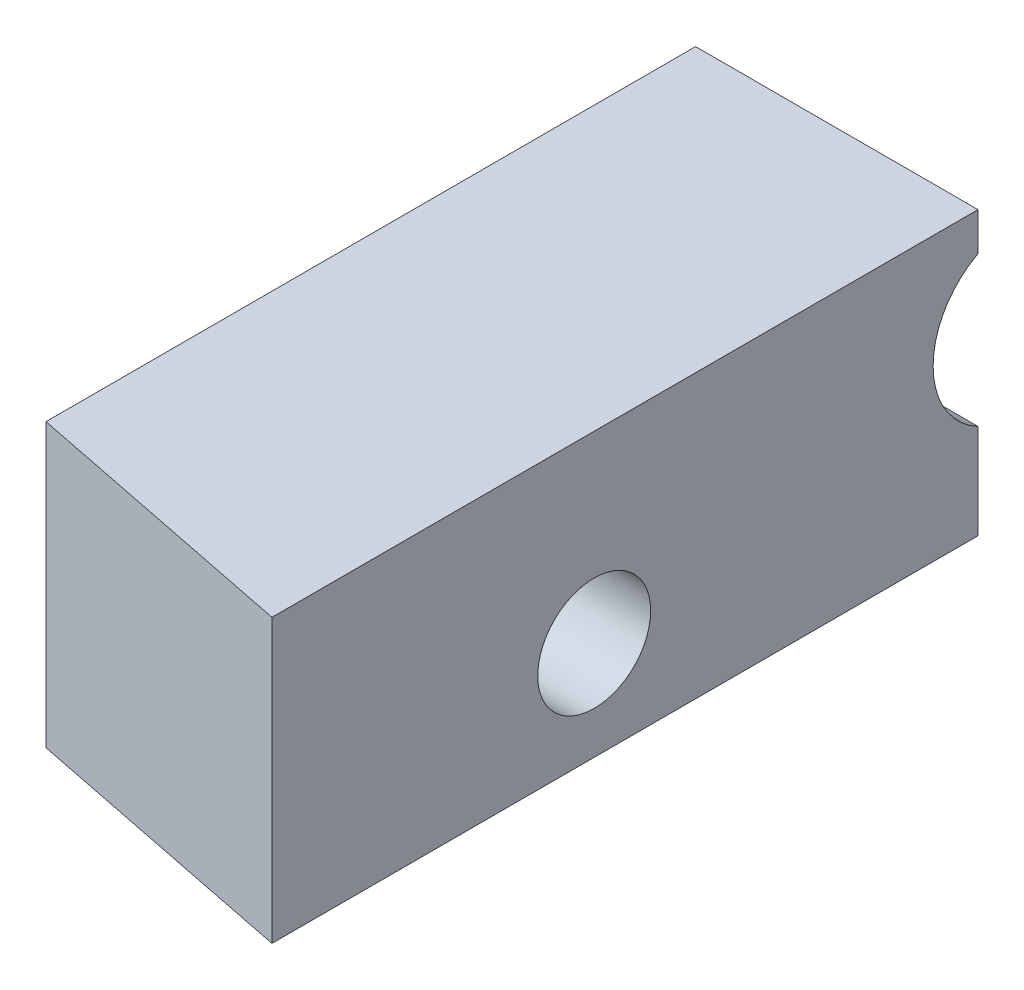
SolidWorks part; units mm, degrees
ref_plane "Plan de face" through (0, 0, 0) normal (0, 0, 1) x (1, 0, 0)
ref_plane "Plan de dessus" through (0, 0, 0) normal (0, 1, 0) x (1, 0, 0)
ref_plane "Plan de droite" through (0, 0, 0) normal (1, 0, 0) x (0, 0, -1)
sketch "Esquisse1" plane through (0, 0, 0) normal (0, 0, 1) x (1, 0, 0)
  line L1 (0, 0) -> (10, 0)
  line L2 (0, 0) -> (0, 10)
  line L3 (0, 10) -> (10, 10)
  line L4 (10, 0) -> (10, 10)
  dimension "D1" = 10
  dimension "D2" = 10
extrude "Extrusion1" add sketch "Esquisse1" along normal blind 25
sketch "Esquisse2" plane through (10, 0, 0) normal (1, 0, 0) x (0, 0, -1)
  line L0 (-25, 10) -> (0, 10) construction
  line L2 (1.4107, 3) -> (1.4107, 9)
  arc A1 (1.4107, 3) -> (1.4107, 9) centre (1.4107, 6) cw
  dimension "D1" = 3
  dimension "D2" = 4
extrude "Enlèv. mat.-Extru.1" cut sketch "Esquisse2" against normal through all
sketch "Esquisse3" plane through (10, 0, 0) normal (1, 0, 0) x (0, 0, -1)
  line L0 (1.4107, 6) -> (-17.6457, 6) construction
  circle A0 centre (-13.5893, 3.5) radius 2
  arc A2 (0, 8.6476) -> (0, 3.3524) centre (1.4107, 6) ccw construction
  dimension "D1" = 4
  dimension "D3" = 15
  dimension "D2" = 2.5
extrude "Enlèv. mat.-Extru.2" cut sketch "Esquisse3" against normal through all
sketch "Esquisse5" plane through (0, 0, 0) normal (0, -1, 0) x (1, 0, 0)
  line L0 (10, 25) -> (0, 23)
  line L1 (0, 25) -> (0, 0) construction
  line L2 (10, 25) -> (8.8293, 26.6151)
  line L3 (8.8293, 26.6151) -> (-1.1647, 26.6151)
  line L4 (-1.1647, 26.6151) -> (0, 23)
  line L6 (0, 25) -> (10, 25) construction
  dimension "D1" = 11.31
extrude "Enlèv. mat.-Extru.4" cut sketch "Esquisse5" against normal through all
